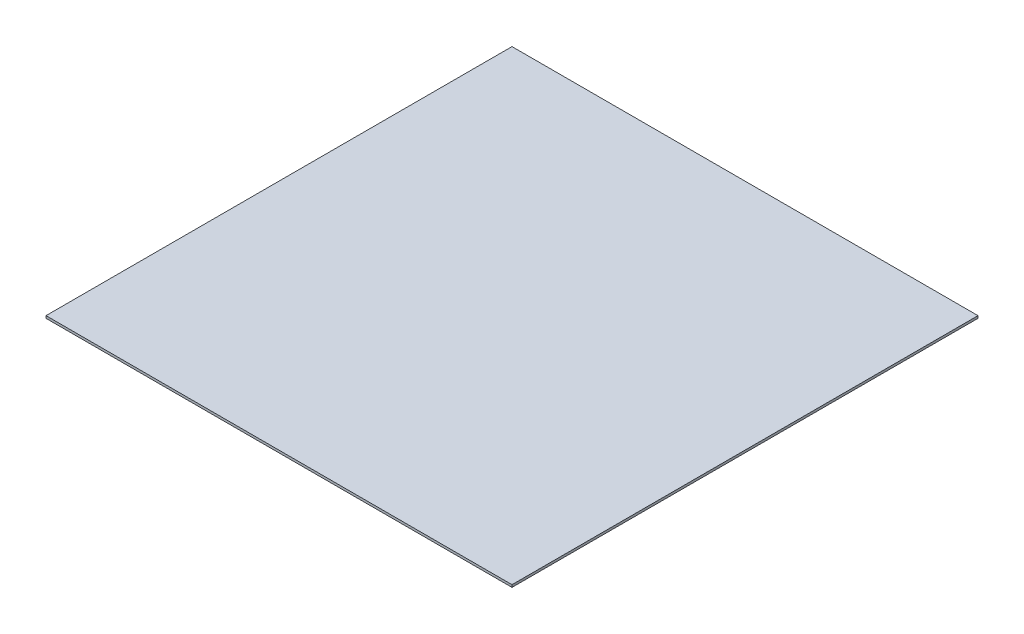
SolidWorks part; units mm, degrees
ref_plane "Front Plane" through (0, 0, 0) normal (0, 0, 1) x (1, 0, 0)
ref_plane "Top Plane" through (0, 0, 0) normal (0, 1, 0) x (1, 0, 0)
ref_plane "Right Plane" through (0, 0, 0) normal (1, 0, 0) x (0, 0, -1)
sketch "Sketch1" plane through (0, 0, 0) normal (1, 0, 0) x (0, 0, -1)
  line L1 (-2500, 12.7) -> (2500, 12.7)
  line L2 (-2500, 12.7) -> (-2500, -12.7)
  line L3 (-2500, -12.7) -> (2500, -12.7)
  line L4 (2500, 12.7) -> (2500, -12.7)
  line L5 (-2500, 12.7) -> (2500, -12.7) construction
  line L6 (-2500, -12.7) -> (2500, 12.7) construction
  point P0 (0, 0)
  dimension "D1" = 25.4
  dimension "D2" = 5000
extrude "Boss-Extrude1" add sketch "Sketch1" along normal mid plane 5000
